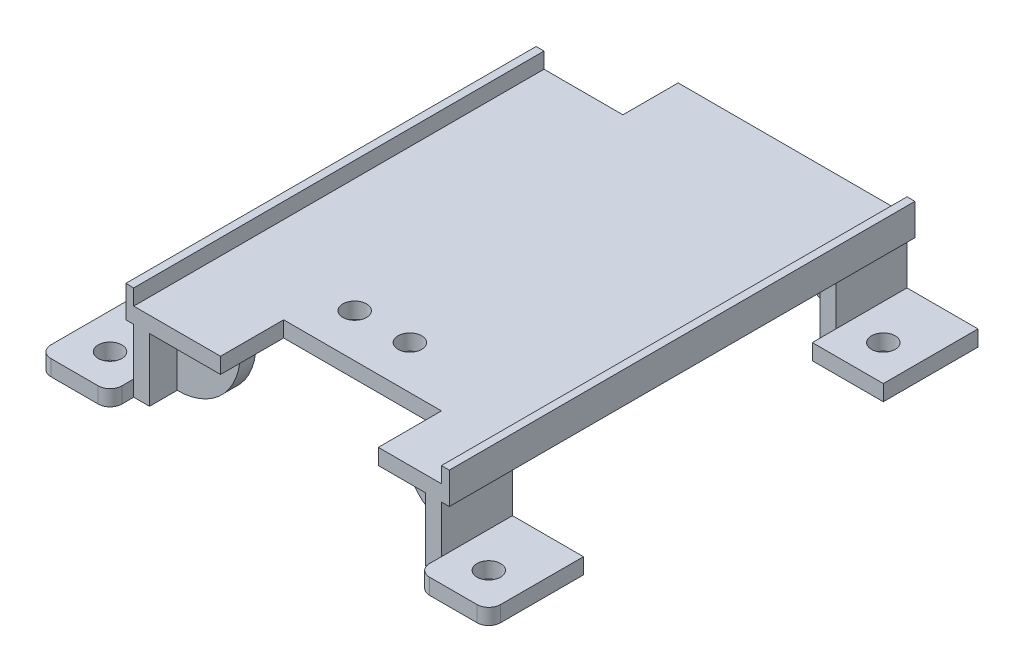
SolidWorks part; units mm, degrees
ref_plane "Front Plane" through (0, 0, 0) normal (0, 0, 1) x (1, 0, 0)
ref_plane "Top Plane" through (0, 0, 0) normal (0, 1, 0) x (1, 0, 0)
ref_plane "Right Plane" through (0, 0, 0) normal (1, 0, 0) x (0, 0, -1)
sketch "Sketch1" plane through (0, 0, 0) normal (0, 1, 0) x (1, 0, 0)
  line L1 (0, 0) -> (57, 0)
  line L2 (0, 0) -> (0, 59)
  line L3 (0, 59) -> (57, 59)
  line L4 (57, 0) -> (57, 59)
  dimension "D1" = 57
  dimension "D2" = 59
extrude "Boss-Extrude1" add sketch "Sketch1" along normal blind 10
sketch "Sketch2" plane through (57, 0, 0) normal (1, 0, 0) x (0, 0, -1)
  line L0 (0, 10) -> (59, 10) construction
  line L1 (9, 10) -> (50, 10)
  line L2 (9, 10) -> (9, 0)
  line L3 (9, 0) -> (50, 0)
  line L4 (50, 10) -> (50, 0)
  line L5 (0, 0) -> (59, 0) construction
  line L6 (0, 10) -> (0, 0) construction
  dimension "D1" = 9
  dimension "D2" = 9
extrude "Cut-Extrude1" cut sketch "Sketch2" against normal blind 9
sketch "Sketch4" plane through (0, 10, 0) normal (0, 1, 0) x (1, 0, 0)
  line L0 (0, 59) -> (0, 0) construction
  line L1 (0, 52) -> (10, 52)
  line L2 (0, 52) -> (0, 59)
  line L3 (0, 59) -> (10, 59)
  line L4 (10, 52) -> (10, 59)
  line L5 (57, 59) -> (0, 59) construction
  dimension "D1" = 10
  dimension "D2" = 7
extrude "Cut-Extrude3" cut sketch "Sketch4" against normal through all
sketch "Sketch5" plane through (0, 0, 0) normal (-1, 0, 0) x (0, 0, 1)
  line L0 (-52, 10) -> (0, 10) construction
  line L1 (-43, 10) -> (-9, 10)
  line L2 (-43, 10) -> (-43, 0)
  line L3 (-43, 0) -> (-9, 0)
  line L4 (-9, 10) -> (-9, 0)
  line L5 (-52, 0) -> (0, 0) construction
  line L6 (-52, 0) -> (-52, 10) construction
  line L7 (0, 10) -> (0, 0) construction
  dimension "D1" = 9
  dimension "D2" = 9
extrude "Cut-Extrude4" cut sketch "Sketch5" against normal blind 9
sketch "Sketch6" plane through (0, 10, 0) normal (0, 1, 0) x (1, 0, 0)
  line L0 (0, 0) -> (57, 0) construction
  line L1 (9, 0) -> (48, 0)
  line L2 (9, 0) -> (9, 59)
  line L3 (9, 59) -> (48, 59)
  line L4 (48, 0) -> (48, 59)
  line L5 (57, 59) -> (10, 59) construction
sketch "Sketch7" plane through (0, 0, 0) normal (0, 0, 1) x (1, 0, 0)
  line L0 (0, 0) -> (57, 0) construction
  line L1 (9, 10) -> (48, 10)
  line L2 (9, 10) -> (9, 0)
  line L3 (9, 0) -> (48, 0)
  line L4 (48, 10) -> (48, 0)
sketch "Sketch8" plane through (0, 0, 0) normal (0, 0, 1) x (1, 0, 0)
  line L0 (9, 10) -> (48, 10) construction
  line L1 (20, 10) -> (40, 10)
  line L2 (20, 10) -> (20, 0)
  line L3 (20, 0) -> (40, 0)
  line L4 (40, 10) -> (40, 0)
  line L5 (9, 0) -> (48, 0) construction
  line L6 (9, 10) -> (9, 0) construction
  point P8 (20, 5)
  dimension "D1" = 11
  dimension "D2" = 20
extrude "Cut-Extrude5" cut sketch "Sketch8" against normal blind 8
sketch "Sketch9" plane through (0, 0, 0) normal (0, -1, 0) x (-1, 0, 0)
  line L0 (-57, 59) -> (-10, 59) construction
  line L1 (-11, 0) -> (-46, 0)
  line L2 (-11, 0) -> (-11, 59)
  line L3 (-11, 59) -> (-46, 59)
  line L4 (-46, 0) -> (-46, 59)
  dimension "D1" = 35
  dimension "D2" = 2
extrude "Cut-Extrude6" cut sketch "Sketch9" against normal blind 8
sketch "Sketch10" plane through (0, 10, 0) normal (0, 1, 0) x (1, 0, 0)
  line L1 (10, 52) -> (19, 52)
  line L2 (10, 52) -> (10, 59)
  line L3 (10, 59) -> (19, 59)
  line L4 (19, 52) -> (19, 59)
  dimension "D1" = 9
extrude "Cut-Extrude7" cut sketch "Sketch10" against normal through all
sketch "Sketch11" plane through (0, 10, 0) normal (0, 1, 0) x (1, 0, 0)
  line L1 (48, 0) -> (57, 0)
  line L2 (48, 0) -> (48, 9)
  line L3 (48, 9) -> (57, 9)
  line L4 (57, 0) -> (57, 9)
extrude "Cut-Extrude8" cut sketch "Sketch11" against normal blind 8
sketch "Sketch12" plane through (0, 10, 0) normal (0, 1, 0) x (1, 0, 0)
  line L1 (48, 59) -> (57, 59)
  line L2 (48, 59) -> (48, 50)
  line L3 (48, 50) -> (57, 50)
  line L4 (57, 59) -> (57, 50)
extrude "Cut-Extrude9" cut sketch "Sketch12" against normal blind 8
sketch "Sketch13" plane through (0, 10, 0) normal (0, 1, 0) x (1, 0, 0)
  line L1 (0, 52) -> (9, 52)
  line L2 (0, 52) -> (0, 43)
  line L3 (0, 43) -> (9, 43)
  line L4 (9, 52) -> (9, 43)
extrude "Cut-Extrude10" cut sketch "Sketch13" against normal blind 8
sketch "Sketch14" plane through (0, 10, 0) normal (0, 1, 0) x (1, 0, 0)
  line L1 (9, 0) -> (0, 0)
  line L2 (9, 0) -> (9, 9)
  line L3 (9, 9) -> (0, 9)
  line L4 (0, 0) -> (0, 9)
extrude "Cut-Extrude11" cut sketch "Sketch14" against normal blind 8
sketch "Sketch15" plane through (0, 0, 0) normal (0, -1, 0) x (-1, 0, 0)
  line L0 (-46, 59) -> (-46, 0) construction
  line L1 (-48, 9) -> (-46, 9)
  line L2 (-48, 9) -> (-48, 50)
  line L3 (-48, 50) -> (-46, 50)
  line L4 (-46, 9) -> (-46, 50)
extrude "Cut-Extrude12" cut sketch "Sketch15" against normal blind 8
sketch "Sketch16" plane through (0, 0, 0) normal (0, -1, 0) x (-1, 0, 0)
  line L0 (-11, 0) -> (-11, 52) construction
  line L1 (-9, 9) -> (-11, 9)
  line L2 (-9, 9) -> (-9, 43)
  line L3 (-9, 43) -> (-11, 43)
  line L4 (-11, 9) -> (-11, 43)
extrude "Cut-Extrude13" cut sketch "Sketch16" against normal blind 8
sketch "Sketch31" plane through (11, 0, 0) normal (1, 0, 0) x (0, 0, -1)
  line L0 (0, 8) -> (9, 8) construction
  line L1 (3.5, 8) -> (5.5, 8)
  line L2 (3.5, 8) -> (3.5, 0)
  line L3 (3.5, 0) -> (5.5, 0)
  line L4 (5.5, 8) -> (5.5, 0)
  line L5 (0, 0) -> (9, 0) construction
  line L6 (0, 8) -> (0, 0) construction
  line L7 (9, 8) -> (9, 0) construction
  point P10 (0, 4)
  dimension "D1" = 3.5
  dimension "D2" = 3.5
revolve "Revolve3" add sketch "Sketch31" angle 90 about L1
sketch "Sketch32" plane through (11, 0, 0) normal (1, 0, 0) x (0, 0, -1)
  line L0 (43, 8) -> (52, 8) construction
  line L1 (46.5, 8) -> (48.5, 8)
  line L2 (46.5, 8) -> (46.5, 0)
  line L3 (46.5, 0) -> (48.5, 0)
  line L4 (48.5, 8) -> (48.5, 0)
  line L5 (43, 0) -> (52, 0) construction
  line L6 (43, 8) -> (43, 0) construction
  line L7 (52, 0) -> (52, 8) construction
  dimension "D1" = 3.5
  dimension "D2" = 3.5
revolve "Revolve4" add sketch "Sketch32" angle 90 about L1
sketch "Sketch33" plane through (0, 8, 0) normal (0, -1, 0) x (1, 0, 0)
  line L0 (40, 0) -> (40, -8) construction
  line L1 (40, -3.5) -> (46, -3.5)
  line L2 (40, -3.5) -> (40, -5.5)
  line L3 (40, -5.5) -> (46, -5.5)
  line L4 (46, -3.5) -> (46, -5.5)
  line L5 (46, -9) -> (46, 0) construction
  line L6 (46, 0) -> (40, 0) construction
  dimension "D1" = 3.5
  dimension "D2" = 3.5
revolve "Revolve5" add sketch "Sketch33" angle 90 about L4
sketch "Sketch34" plane through (46, 0, 0) normal (-1, 0, 0) x (0, 0, 1)
  line L0 (-59, 0) -> (-50, 0) construction
  line L1 (-53.5, 0) -> (-55.5, 0)
  line L2 (-53.5, 0) -> (-53.5, 8)
  line L3 (-53.5, 8) -> (-55.5, 8)
  line L4 (-55.5, 0) -> (-55.5, 8)
  line L5 (-59, 8) -> (-50, 8) construction
  line L6 (-50, 8) -> (-50, 0) construction
  line L7 (-59, 8) -> (-59, 0) construction
  point P10 (-55.5, 4)
  dimension "D1" = 3.5
  dimension "D2" = 3.5
revolve "Revolve6" add sketch "Sketch34" angle 90 about L3
sketch "Sketch42" plane through (0, 10, 0) normal (0, 1, 0) x (1, 0, 0)
  line L0 (9, 0) -> (9, 52) construction
  line L1 (48, 59) -> (48, 0) construction
  line L2 (48, 59) -> (19, 59) construction
  circle A0 centre (23.5, 13.5) radius 1.5
  circle A1 centre (30.5, 13.5) radius 1.5
  dimension "D5" = 3
  dimension "D6" = 3
  dimension "D1" = 14.5
  dimension "D2" = 17.5
  dimension "D3" = 45.5
  dimension "D4" = 45.5
extrude "Cut-Extrude15" cut sketch "Sketch42" against normal through all
sketch "Sketch46" plane through (48, 0, 0) normal (1, 0, 0) x (0, 0, -1)
  line L0 (59, 2) -> (59, 10) construction
  line L1 (0, 10) -> (59, 10)
  line L2 (0, 10) -> (0, 8)
  line L3 (0, 8) -> (59, 8)
  line L4 (59, 10) -> (59, 8)
extrude "Boss-Extrude3" add sketch "Sketch46" along normal blind 1
sketch "Sketch47" plane through (0, 10, 0) normal (0, 1, 0) x (1, 0, 0)
  line L0 (40, 0) -> (49, 0) construction
  line L1 (49, 59) -> (48, 59)
  line L2 (49, 59) -> (49, 0)
  line L3 (49, 0) -> (48, 0)
  line L4 (48, 59) -> (48, 0)
  dimension "D1" = 1
extrude "Boss-Extrude4" add sketch "Sketch47" along normal blind 2
sketch "Sketch48" plane through (9, 0, 0) normal (-1, 0, 0) x (0, 0, 1)
  line L1 (-52, 10) -> (0, 10)
  line L2 (-52, 10) -> (-52, 8)
  line L3 (-52, 8) -> (0, 8)
  line L4 (0, 10) -> (0, 8)
extrude "Boss-Extrude5" add sketch "Sketch48" along normal blind 1
sketch "Sketch49" plane through (0, 10, 0) normal (0, 1, 0) x (1, 0, 0)
  line L0 (8, 0) -> (20, 0) construction
  line L1 (8, 52) -> (9, 52)
  line L2 (8, 52) -> (8, 0)
  line L3 (8, 0) -> (9, 0)
  line L4 (9, 52) -> (9, 0)
  dimension "D1" = 1
extrude "Boss-Extrude6" add sketch "Sketch49" along normal blind 2
sketch "Sketch50" plane through (0, 0, 0) normal (0, 0, 1) x (1, 0, 0)
  line L0 (0, 0) -> (11, 0) construction
  line L1 (0, 2) -> (9, 2)
  line L2 (0, 2) -> (0, 0)
  line L3 (0, 0) -> (9, 0)
  line L4 (9, 2) -> (9, 0)
  line L6 (48, 2) -> (57, 2)
  line L7 (48, 2) -> (48, 0)
  line L8 (48, 0) -> (57, 0)
  line L9 (57, 2) -> (57, 0)
extrude "Boss-Extrude7" add sketch "Sketch50" along normal blind 3
sketch "Sketch51" plane through (0, 0, -43) normal (0, 0, 1) x (1, 0, 0)
  line L1 (9, 2) -> (0, 2)
  line L2 (9, 2) -> (9, 0)
  line L3 (9, 0) -> (0, 0)
  line L4 (0, 2) -> (0, 0)
extrude "Boss-Extrude8" add sketch "Sketch51" along normal blind 3
sketch "Sketch52" plane through (0, 0, -50) normal (0, 0, 1) x (1, 0, 0)
  line L1 (48, 2) -> (57, 2)
  line L2 (48, 2) -> (48, 0)
  line L3 (48, 0) -> (57, 0)
  line L4 (57, 2) -> (57, 0)
extrude "Boss-Extrude9" add sketch "Sketch52" along normal blind 3
sketch "Sketch53" plane through (0, 2, 0) normal (0, 1, 0) x (1, 0, 0)
  line L0 (9, 52) -> (0, 52) construction
  line L1 (0, 52) -> (0, 40) construction
  line L2 (57, 59) -> (48, 59) construction
  line L3 (57, 47) -> (57, 59) construction
  line L4 (9, 9) -> (0, 9) construction
  line L5 (0, 9) -> (0, -3) construction
  line L6 (57, 9) -> (48, 9) construction
  line L7 (57, -3) -> (57, 9) construction
  circle A0 centre (4.5, 44.5) radius 1.5
  circle A1 centre (52.5, 51.5) radius 1.5
  circle A2 centre (52.5, 1.5) radius 1.5
  circle A3 centre (4.5, 1.5) radius 1.5
  dimension "D1" = 3
  dimension "D4" = 3
  dimension "D7" = 3
  dimension "D10" = 3
  dimension "D2" = 7.5
  dimension "D3" = 4.5
  dimension "D5" = 7.5
  dimension "D6" = 4.5
  dimension "D8" = 7.5
  dimension "D9" = 4.5
  dimension "D11" = 7.5
  dimension "D12" = 4.5
extrude "Cut-Extrude16" cut sketch "Sketch53" against normal through all
fillet "Fillet2" radius 1.5 4 edges at (57, 1, 3) (48, 1, 3) (9, 1, 3) (0, 1, 3)
